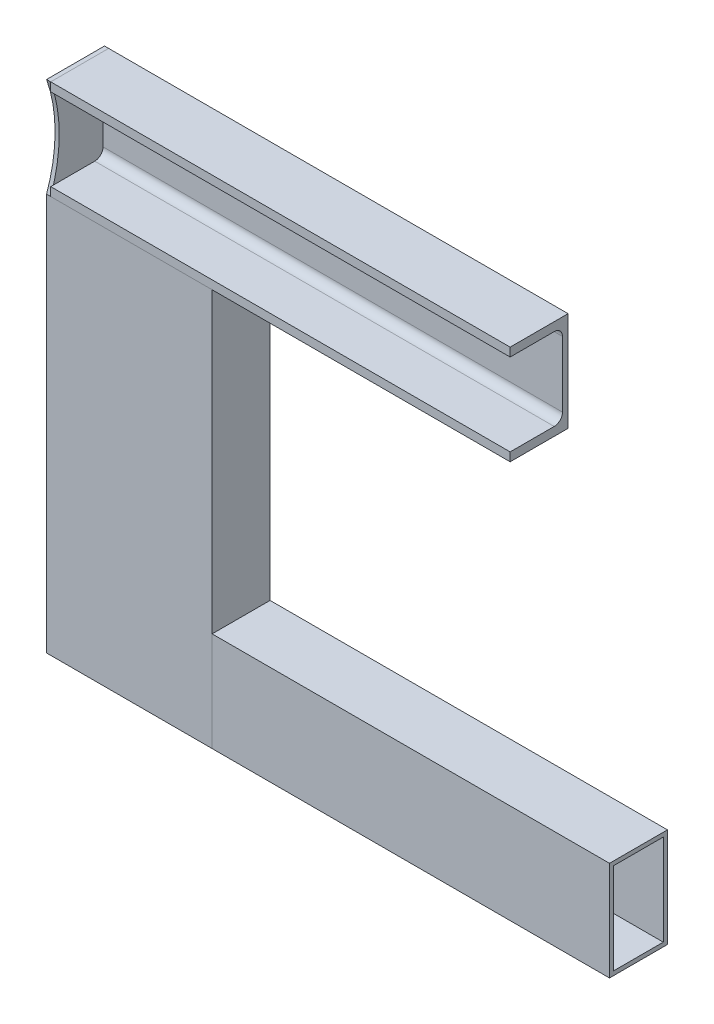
SolidWorks part; units mm, degrees
ref_plane "Front Plane" through (0, 0, 0) normal (0, 0, 1) x (1, 0, 0)
ref_plane "Top Plane" through (0, 0, 0) normal (0, 1, 0) x (1, 0, 0)
ref_plane "Right Plane" through (0, 0, 0) normal (1, 0, 0) x (0, 0, -1)
sketch "Sketch1" plane through (0, 0, 0) normal (0, 0, 1) x (1, 0, 0)
  line L0 (0, 0) -> (355.6, 0)
  line L1 (0, 0) -> (0, -381)
  line L4 (0, -381) -> (431.8, -381)
  dimension "D1" = 355.6
  dimension "D2" = 381
  dimension "D3" = 431.8
other "Structural Member1"
ref_plane "Plane1" through (0, 0, 0) normal (1, 0, 0) x (0, 1, 0)
sketch "Sketch11" plane through (0, -38.1, 0) normal (1, 0, 0) x (0, 0, 1)
  line L0 (0, 38.1) -> (0, -38.1)
  line L1 (0, 38.1) -> (44.45, 38.1)
  line L2 (4.318, 25.146) -> (4.318, -25.146)
  line L3 (0, 0) -> (69.2179, 0) construction
  line L4 (10.668, -31.496) -> (44.45, -31.496)
  line L5 (44.45, -38.1) -> (44.45, -31.496)
  line L6 (0, 0) -> (4.318, 0) construction
  line L7 (0, -38.1) -> (44.45, -38.1)
  line L15 (44.45, 38.1) -> (44.45, 31.496)
  line L17 (10.668, 31.496) -> (44.45, 31.496)
  arc A0 (4.318, -25.146) -> (10.668, -31.496) centre (10.668, -25.146) ccw
  arc A10 (4.318, 25.146) -> (10.668, 31.496) centre (10.668, 25.146) cw
  point P4 (44.45, 31.496)
  point P6 (2.159, 0)
  point P7 (22.225, 38.1)
  point P9 (22.225, -38.1)
  point P12 (44.45, -31.496)
  point P16 (0, 0)
  dimension "RI" = 6.35
  dimension "D2" = 44.45
  dimension "flange" = 6.604
  dimension "D1" = 4.318
  dimension "D3" = 38.1
other "Structural Member5"
ref_plane "Plane5" through (0, 0, 0) normal (0, -1, 0) x (1, 0, 0)
sketch "Sketch17" plane through (63.5, 0, 44.45) normal (0, -1, 0) x (0, 0, -1)
  line L0 (3.175, -60.325) -> (41.275, -60.325)
  line L1 (0, -63.5) -> (44.45, -63.5)
  line L2 (0, -63.5) -> (0, 63.5)
  line L3 (0, 0) -> (69.2179, 0) construction
  line L4 (0, 63.5) -> (44.45, 63.5)
  line L5 (44.45, -63.5) -> (44.45, 63.5)
  line L6 (41.275, -60.325) -> (41.275, 60.325)
  line L7 (3.175, 60.325) -> (41.275, 60.325)
  line L8 (3.175, -60.325) -> (3.175, 60.325)
  point P9 (0, 0)
  dimension "D2" = 127
  dimension "D1" = 44.45
  dimension "D3" = 3.175
other "Structural Member6"
ref_plane "Plane6" through (0, -381, 0) normal (1, 0, 0) x (0, 1, 0)
sketch "Sketch110" plane through (0, -381, 22.225) normal (1, 0, 0) x (0, 1, 0)
  line L0 (3.175, -19.05) -> (73.025, -19.05)
  line L1 (0, -22.225) -> (76.2, -22.225)
  line L2 (0, -22.225) -> (0, 22.225)
  line L3 (0, 0) -> (69.2179, 0) construction
  line L4 (0, 22.225) -> (76.2, 22.225)
  line L5 (76.2, -22.225) -> (76.2, 22.225)
  line L6 (73.025, -19.05) -> (73.025, 19.05)
  line L7 (3.175, 19.05) -> (73.025, 19.05)
  line L8 (3.175, -19.05) -> (3.175, 19.05)
  point P9 (0, 0)
  dimension "D2" = 44.45
  dimension "D1" = 76.2
  dimension "D3" = 3.175
sketch "Sketch115" plane through (0, 0, 44.45) normal (0, 0, 1) x (1, 0, 0)
  line L0 (127, -76.2) -> (3.175, -76.2)
  line L1 (355.6, -76.2) -> (0, -76.2) construction
  line L2 (3.175, -76.2) -> (3.175, 0)
  line L3 (0, 0) -> (355.6, 0) construction
  line L4 (3.175, 0) -> (127, 0)
  line L5 (127, -381) -> (127, 0) construction
  line L6 (127, 0) -> (127, -76.2)
  line L7 (0, 0) -> (0, -381) construction
  dimension "D1" = 3.175
extrude "Extrude11" cut sketch "Sketch115" against normal through all
sketch "Sketch116" plane through (0, 0, 44.45) normal (0, 0, 1) x (1, 0, 0)
  line L0 (3.175, -76.2) -> (127, -76.2) construction
  line L2 (0, 0) -> (3.175, 0)
  line L3 (0, 0) -> (0, -76.2)
  line L4 (0, -76.2) -> (3.175, -76.2)
  line L6 (3.175, 0) -> (3.175, -76.2)
  line L7 (355.6, -76.2) -> (0, -76.2) construction
extrude "Extrude12" cut sketch "Sketch116" against normal through all
sketch "Sketch14" plane through (355.6, 0, 0) normal (1, 0, 0) x (0, 0, -1)
  circle A0 centre (-152.2131, -38.1) radius 114.3
  dimension "D1" = 228.6
extrude "Extrude1" cut sketch "Sketch14" against normal through all
other "Trim/Extend1"
